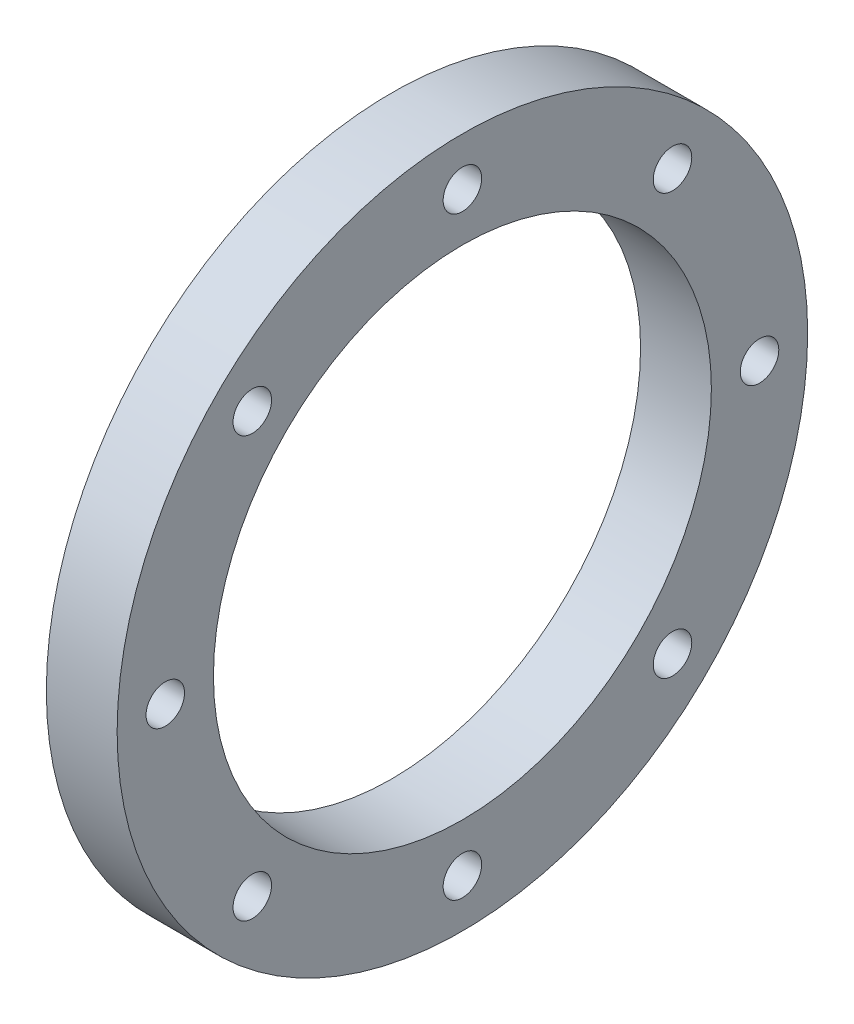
SolidWorks part; units mm, degrees
ref_plane "Front" through (0, 0, 0) normal (0, 0, 1) x (1, 0, 0)
ref_plane "Top" through (0, 0, 0) normal (0, 1, 0) x (1, 0, 0)
ref_plane "Right" through (0, 0, 0) normal (1, 0, 0) x (0, 0, -1)
sketch "Sketch1" plane through (0, 0, 0) normal (0, 0, 1) x (1, 0, 0)
  line L0 (-95.25, -28.3718) -> (-95.25, 28.6766) construction
  line L1 (-95.25, 22.3266) -> (-88.9, 22.3266)
  line L2 (-95.25, 22.3266) -> (-95.25, 30.9626)
  line L3 (-95.25, 30.9626) -> (-88.9, 30.9626)
  line L4 (-88.9, 22.3266) -> (-88.9, 30.9626)
  line L6 (0, 0) -> (-80.0493, 0) construction
  line L7 (-88.9, -20.5359) -> (-88.9, 23.8125) construction
  dimension "D1" = 6.35
  dimension "D2" = 61.9252
  dimension "D3" = 44.6532
  dimension "D4" = 88.9
revolve "Revolve1" add sketch "Sketch1" angle 360 about L6
hole_wizard "#8-32 Tapped Hole1" positions "Sketch3" profile "Sketch2" tap size "#8-32" standard "Ansi Inch"
sketch "Sketch3" plane through (-88.9, 0, 0) normal (1, 0, 0) x (0, 0, -1)
  line L0 (-22.3266, 0) -> (-30.9626, 0) construction
  line L3 (-21.8939, 21.8939) -> (-15.7873, 15.7873) construction
  circle A3 centre (0, 0) radius 30.9626 construction
  circle A4 centre (0, 0) radius 22.3266 construction
  point P0 (-26.6446, 0)
  point P39 (-18.8406, 18.8406)
  point P40 (0, 26.6446)
  point P41 (18.8406, 18.8406)
  point P42 (26.6446, 0)
  point P43 (18.8406, -18.8406)
  point P44 (0, -26.6446)
  point P45 (-18.8406, -18.8406)
  dimension "D1" = 45
sketch "Sketch2" plane through (-88.9, 0, 26.6446) normal (0, 1, 0) x (0, 0, -1)
  line L0 (0, 0) -> (0, 6.35)
  line L1 (0, 6.35) -> (1.7272, 6.35)
  line L2 (1.7272, 6.35) -> (1.7272, 0)
  line L5 (1.7272, 0) -> (0, 0)
  line L11 (0, -6.35) -> (0, 107.95) construction
  dimension "Thru Tap Drill Dia." = 3.4544
  dimension "Thru Tap Drill Depth" = 6.35
